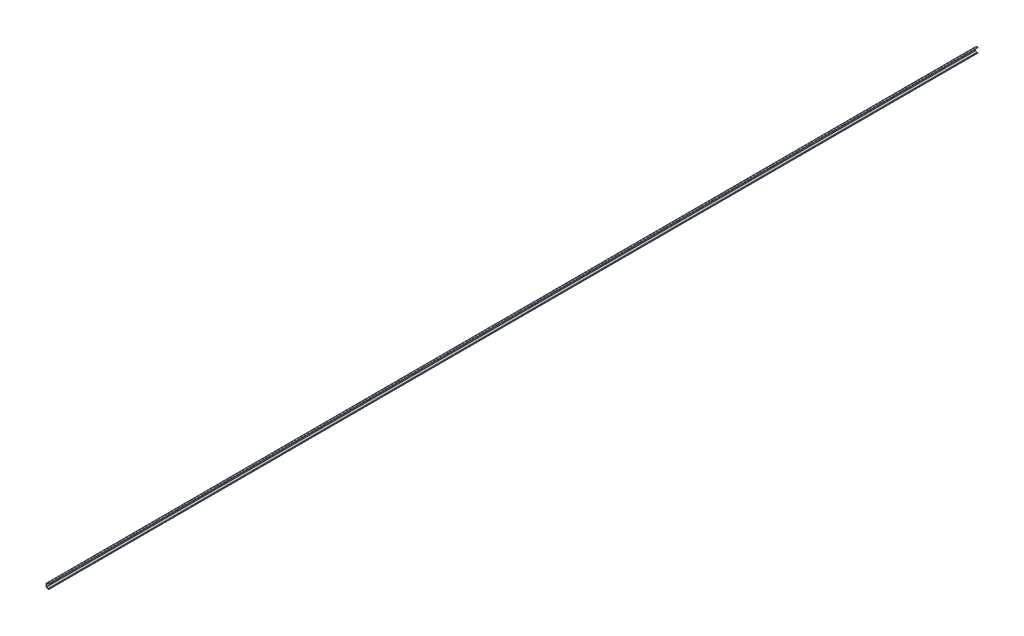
SolidWorks part; units mm, degrees
ref_plane "Front Plane" through (0, 0, 0) normal (0, 0, 1) x (1, 0, 0)
ref_plane "Top Plane" through (0, 0, 0) normal (0, 1, 0) x (1, 0, 0)
ref_plane "Right Plane" through (0, 0, 0) normal (1, 0, 0) x (0, 0, -1)
sketch "Sketch1" plane through (0, 0, 0) normal (0, 0, 1) x (1, 0, 0)
  line L0 (8.8528, 6.5211) -> (10, 8.1594)
  line L1 (10, 8.1594) -> (8.6321, 9.1172)
  line L2 (5.3679, 9.1172) -> (1.3827, 6.3267)
  line L3 (0, 3.8) -> (0, -3.8)
  line L4 (1.3827, -6.3267) -> (5.3679, -9.1172)
  line L5 (8.6321, -9.1172) -> (10, -8.1594)
  line L6 (10, -8.1594) -> (8.8528, -6.5211)
  line L7 (8.8528, -6.5211) -> (7.522, -7.453)
  line L8 (6.478, -7.453) -> (2.3691, -4.5758)
  line L9 (2, -3.8) -> (2, 3.8)
  line L10 (2.3691, 4.5758) -> (6.478, 7.453)
  line L12 (7.522, 7.453) -> (8.8528, 6.5211)
  arc A0 (8.6321, 9.1172) -> (5.3679, 9.1172) centre (7, 6.7863) ccw
  arc A1 (1.3827, 6.3267) -> (0, 3.8) centre (3.2464, 3.6652) ccw
  arc A2 (0, -3.8) -> (1.3827, -6.3267) centre (3, -3.8) ccw
  arc A3 (5.3679, -9.1172) -> (8.6321, -9.1172) centre (7, -6.7863) ccw
  arc A4 (7.522, -7.453) -> (6.478, -7.453) centre (7, -6.7075) cw
  arc A5 (2.3691, -4.5758) -> (2, -3.8) centre (2.8685, -3.8626) cw
  arc A6 (2, 3.8) -> (2.3691, 4.5758) centre (3, 3.8) cw
  arc A7 (6.478, 7.453) -> (7.522, 7.453) centre (7, 6.7075) cw
  dimension "D1" = 2.8455
  dimension "D2" = 3.2492
  dimension "D3" = 3
  dimension "D4" = 2.8455
  dimension "D5" = 0.91
  dimension "D6" = 0.8708
  dimension "D7" = 1
  dimension "D8" = 0.91
  dimension "D9" = 1.3827
  dimension "D10" = 1.3827
  dimension "D11" = 2
  dimension "D12" = 2.3691
  dimension "D13" = 2.8685
  dimension "D14" = 2.3691
  dimension "D15" = 3.2464
  dimension "D16" = 5.3679
  dimension "D17" = 3
  dimension "D18" = 5.3679
  dimension "D19" = 6.478
  dimension "D20" = 6.478
  dimension "D21" = 7
  dimension "D22" = 7.522
  dimension "D23" = 3.6652
  dimension "D24" = 3.8
  dimension "D31" = 8.8528
  dimension "D32" = 8.8528
  dimension "D33" = 10
  dimension "D34" = 10
extrude "Extrude1" add sketch "Sketch1" against normal blind 3120
sketch "Sketch2" plane through (2, 0, 0) normal (1, 0, 0) x (0, 0, -1)
  line L0 (38.75, 0) -> (41.25, 0) construction
  line L1 (38.75, 2.25) -> (41.25, 2.25)
  line L2 (38.75, -2.25) -> (41.25, -2.25)
  arc A0 (38.75, 2.25) -> (38.75, -2.25) centre (38.75, 0) ccw
  arc A1 (41.25, -2.25) -> (41.25, 2.25) centre (41.25, 0) ccw
  point P6 (40, 0)
  dimension "D1" = 2.5
  dimension "D2" = 4.5
  dimension "D3" = 40
extrude "Extrude2" cut sketch "Sketch2" against normal through all
pattern_linear "LPattern1" count 39 spacing 80 along (0, 0, -1) of "Extrude2"
